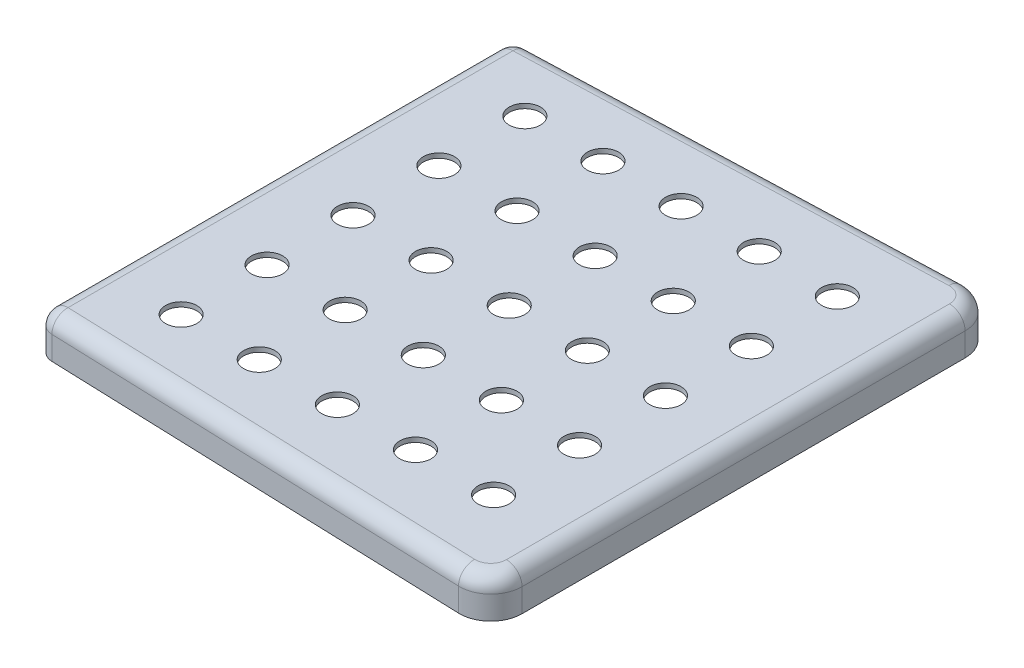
SolidWorks part; units mm, degrees
ref_plane "Plan de face" through (0, 0, 0) normal (0, 0, 1) x (1, 0, 0)
ref_plane "Plan de dessus" through (0, 0, 0) normal (0, 1, 0) x (1, 0, 0)
ref_plane "Plan de droite" through (0, 0, 0) normal (1, 0, 0) x (0, 0, -1)
sketch "Esquisse1" plane through (0, 0, 0) normal (0, 1, 0) x (1, 0, 0)
  line L0 (-145.0086, -628.0615) -> (1354.9914, -628.0615) construction
  dimension "D1" = 1500
sketch "Esquisse2" plane through (0, 0, 0) normal (0, 1, 0) x (1, 0, 0)
  line L0 (0, 0) -> (-117.094, 0) construction
  line L1 (-150, 152.0238) -> (150, 162.5)
  line L2 (-150, 152.0238) -> (-150, -152.0238)
  line L3 (-150, -152.0238) -> (150, -162.5)
  line L4 (150, 162.5) -> (150, -162.5)
  point P0 (0, 0)
  point P8 (0, 157.2619)
  dimension "D1" = 88
  dimension "D2" = 300
  dimension "D3" = 325
extrude "Boss.-Extru.1" add sketch "Esquisse2" against normal blind 25
fillet "Congé1" radius 10 2 edges at (-150, -12.5, 152.0238) (-150, -12.5, -152.0238)
fillet "Congé2" radius 20 2 edges at (150, -12.5, 162.5) (150, -12.5, -162.5)
fillet "Congé3" radius 10 8 edges at (-147.1934, 0, 149.3135) (-150, 0, 0) (-147.1934, 0, -149.3135) (-5.5235, 0, -157.069) (143.8932, 0, -156.1762) (150, 0, 0) (143.8932, 0, 156.1762) (-5.5235, 0, 157.069)
shell "Coque1" thickness 3
sketch "Esquisse3" plane through (0, 0, 0) normal (0, 1, 0) x (1, 0, 0)
  circle A0 centre (-100, 110) radius 10
  dimension "D1" = 20
  dimension "D2" = 100
  dimension "D3" = 110
extrude "Enlèv. mat.-Extru.1" cut sketch "Esquisse3" against normal through all
pattern_linear "Répétition linéaire1" count 5 spacing 50 along (1, 0, 0) count 5 spacing 55 along (0, 0, 1) of "Enlèv. mat.-Extru.1"
